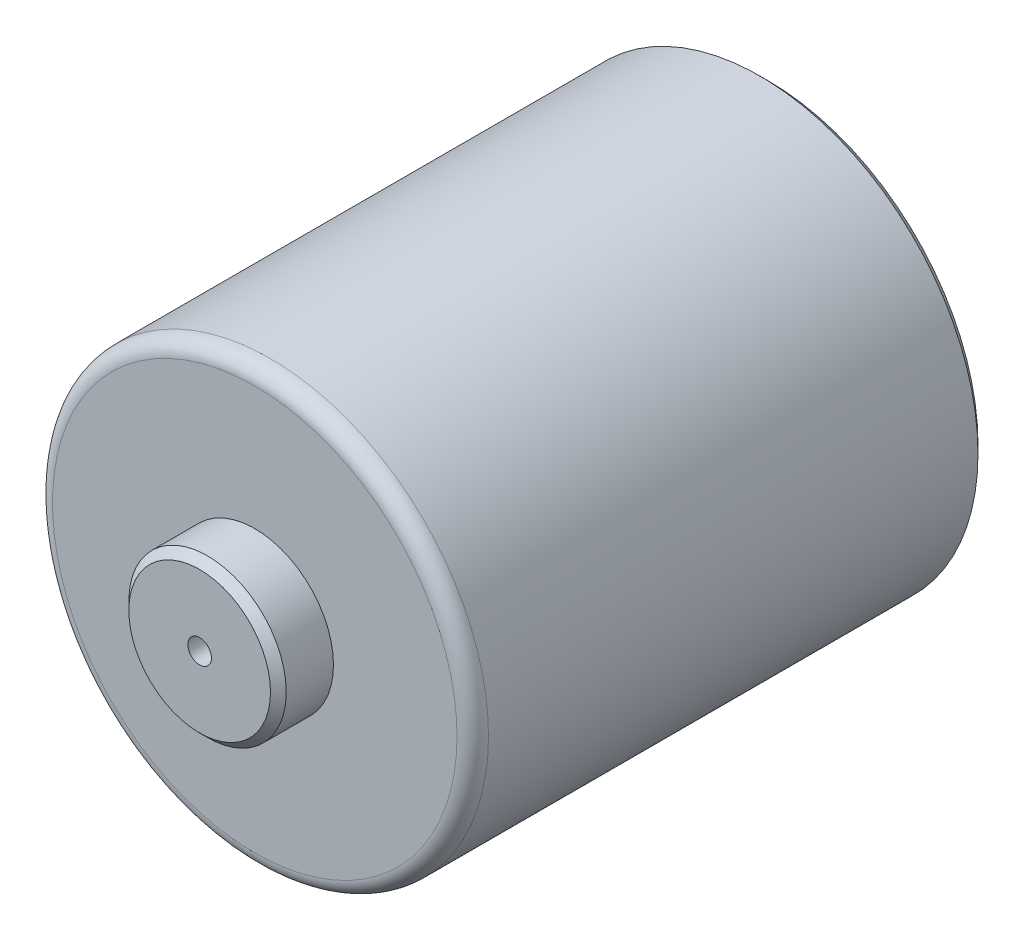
SolidWorks part; units mm, degrees
ref_plane "Plan de face" through (0, 0, 0) normal (0, 0, 1) x (1, 0, 0)
ref_plane "Plan de dessus" through (0, 0, 0) normal (0, 1, 0) x (1, 0, 0)
ref_plane "Plan de droite" through (0, 0, 0) normal (1, 0, 0) x (0, 0, -1)
sketch "Esquisse1" plane through (0, 0, 0) normal (0, 0, 1) x (1, 0, 0)
  circle A0 centre (0, 0) radius 13.85
  dimension "D1" = 27.7
extrude "Extrusion1" add sketch "Esquisse1" along normal blind 32.6
sketch "Esquisse2" plane through (0, 0, 32.6) normal (0, 0, 1) x (1, 0, 0)
  circle A0 centre (0, 0) radius 5
  dimension "D1" = 10
extrude "Extrusion2" add sketch "Esquisse2" along normal blind 3.5
sketch "Esquisse3" plane through (0, 0, 0) normal (0, 0, -1) x (-1, 0, 0)
  circle A0 centre (0, 0) radius 5
  dimension "D1" = 10
extrude "Extrusion3" add sketch "Esquisse3" along normal blind 2.2
chamfer "Chanfrein1" distance 0.5 angle 45 3 edges at (-5, 0, -2.2) (13.85, 0, 0) (5, 0, 36.1)
fillet "Congé1" radius 1 1 edges at (13.85, 0, 32.6)
sketch "Esquisse4" plane through (0, 0, 36.1) normal (0, 0, 1) x (1, 0, 0)
  circle A0 centre (0, 0) radius 0.75
  dimension "D1" = 1.5
extrude "Enlèv. mat.-Extru.1" cut sketch "Esquisse4" against normal through all
